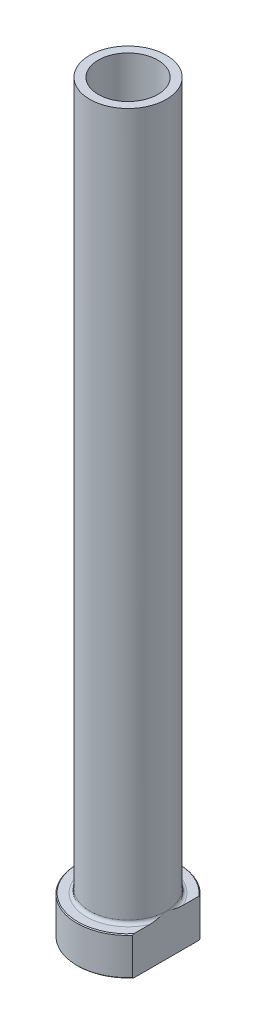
SolidWorks part; units mm, degrees
ref_plane "Front Plane" through (0, 0, 0) normal (0, 0, 1) x (1, 0, 0)
ref_plane "Top Plane" through (0, 0, 0) normal (0, 1, 0) x (1, 0, 0)
ref_plane "Right Plane" through (0, 0, 0) normal (1, 0, 0) x (0, 0, -1)
sketch "Sketch1" plane through (0, 0, 0) normal (0, 0, 1) x (1, 0, 0)
  line L0 (-7, 175) -> (-9, 175)
  line L1 (-9, 175) -> (-9, 9)
  line L2 (-9, 9) -> (-12, 9)
  line L3 (-12, 9) -> (-12, 0)
  line L4 (11.55, 0) -> (-11.55, 0) construction
  line L5 (-12, 0) -> (-7.25, 0)
  line L6 (-7, 120) -> (-7, 175)
  line L7 (0, 92.1877) -> (0, -15.5353) construction
  line L8 (0, -13.2) -> (0, 13.2) construction
  line L9 (-7, 120) -> (-7.25, 108)
  line L10 (-7.25, 108) -> (-7.25, 0)
  dimension "D1" = 0.25
  dimension "ID" = 14
  dimension "OD" = 18
  dimension "L" = 175
  dimension "H" = 24
  dimension "T" = 9
  dimension "N" = 55
  dimension "D2" = 12
  dimension "L-N" = 120
revolve "Revolve1" add sketch "Sketch1" angle 360 about L7
fillet "Fillet1" radius 0.8 1 edges at (0, 9, 9)
chamfer "Chamfer1" distance 0.2 angle 45 2 edges at (0, 9, 12) (0, 0, 12)
sketch "Sketch2" plane through (0, 0, 0) normal (0, -1, 0) x (1, 0, 0)
  line L0 (9, 7.9373) -> (9, -7.9373)
  circle A0 centre (0, 0) radius 12 construction
  arc A1 (9, 7.9373) -> (9, -7.9373) centre (0, 0) cw
  circle A2 centre (0, 0) radius 9 construction
extrude "Cut-Extrude1" cut sketch "Sketch2" against normal through all
chamfer "Chamfer2" distance 0.5 angle 45 1 edges at (0, 0, 7.25)
